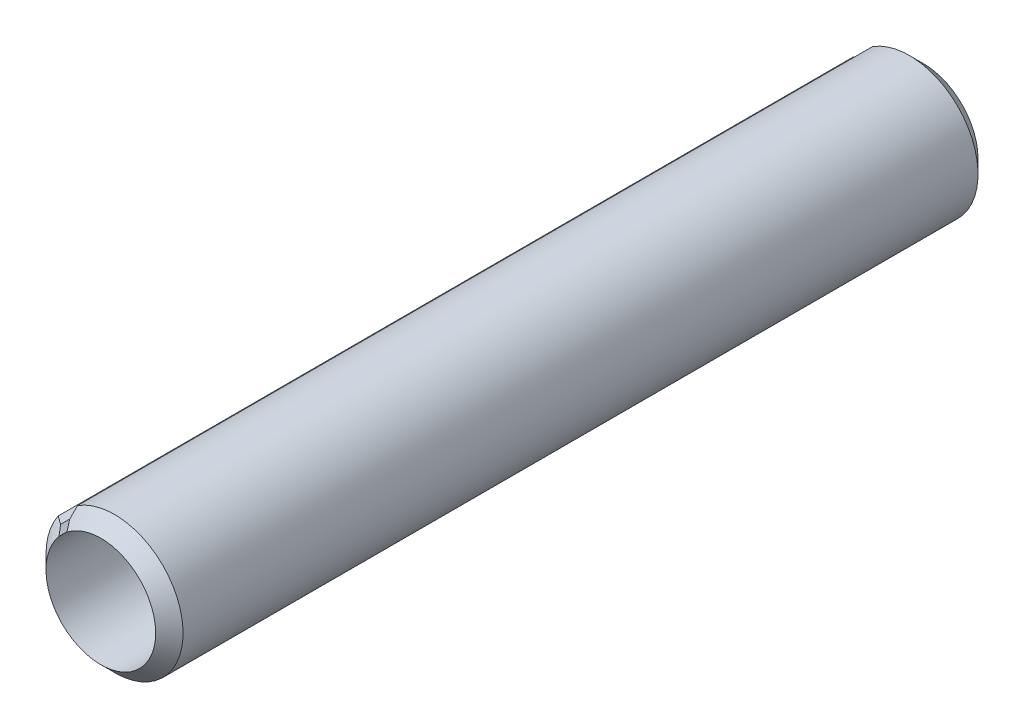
SolidWorks part; units mm, degrees
ref_plane "Plan de face" through (0, 0, 0) normal (0, 0, 1) x (1, 0, 0)
ref_plane "Plan de dessus" through (0, 0, 0) normal (0, 1, 0) x (1, 0, 0)
ref_plane "Plan de droite" through (0, 0, 0) normal (1, 0, 0) x (0, 0, -1)
sketch "Esquisse1" plane through (0, 0, 0) normal (0, 0, 1) x (1, 0, 0)
  line L0 (0, 0) -> (-0.7894, 1.0046) construction
  line L1 (0, 0) -> (-0.8691, 0.7363) construction
  line L2 (-0.3089, 0.3931) -> (-0.2472, 0.3145)
  line L3 (-0.3815, 0.3232) -> (-0.3052, 0.2586)
  line L4 (0, 0) -> (-0.7127, 0) construction
  arc A0 (-0.2472, 0.3145) -> (-0.3052, 0.2586) centre (0, 0) cw
  arc A1 (-0.3089, 0.3931) -> (-0.3815, 0.3232) centre (0, 0) cw
  dimension "D1" = 0.5
  dimension "D2" = 0.4
  dimension "D3" = 11.564
  dimension "D4" = 40.274
extrude "Boss.-Extru.1" add sketch "Esquisse1" along normal blind 6
chamfer "Chanfrein1" distance 0.1 angle 45 1 edges at (0.347, -0.36, 6)
chamfer "Chanfrein2" distance 0.1 angle 45 1 edges at (0.347, -0.36, 0)
chamfer "Chanfrein3" distance 0.05 angle 45 1 edges at (-0.3815, 0.3232, 3)
chamfer "Chanfrein5" distance 0.05 angle 45 1 edges at (-0.3089, 0.3931, 3)
